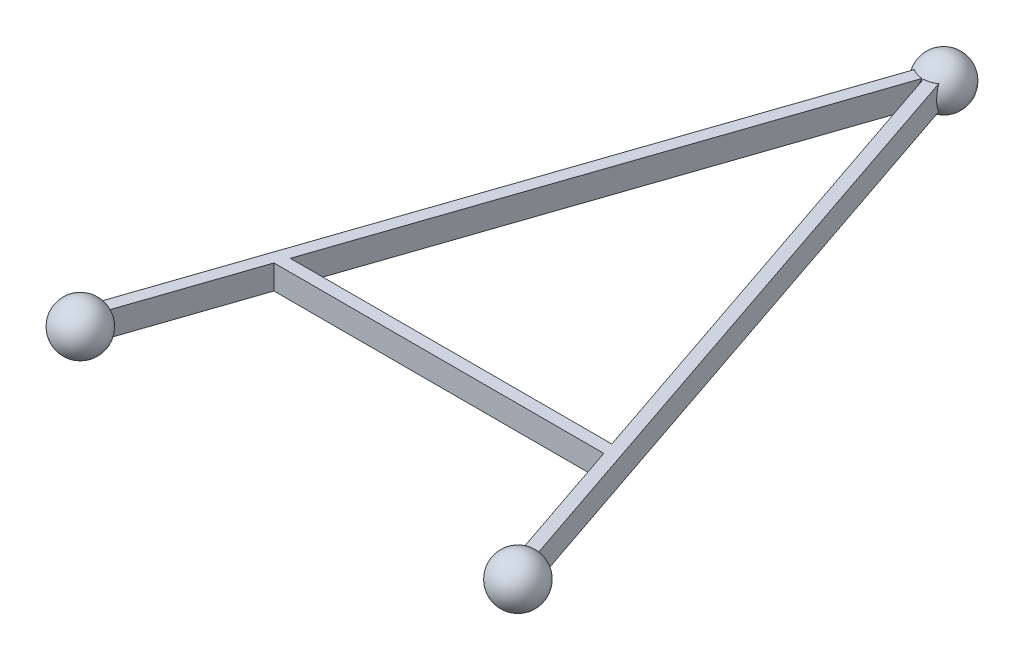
SolidWorks part; units mm, degrees
ref_plane "Front Plane" through (0, 0, 0) normal (0, 0, 1) x (1, 0, 0)
ref_plane "Top Plane" through (0, 0, 0) normal (0, 1, 0) x (1, 0, 0)
ref_plane "Right Plane" through (0, 0, 0) normal (1, 0, 0) x (0, 0, -1)
sketch "Sketch2" plane through (0, 0, 0) normal (0, 1, 0) x (1, 0, 0)
  line L0 (0, 0) -> (-114.3, 336.7297)
  line L1 (-114.3, 336.7297) -> (-228.6, 0)
  line L2 (-228.6, 0) -> (0, 0)
  line L3 (-202.7346, 76.2) -> (-25.8654, 76.2)
  dimension "D1" = 355.6
  dimension "D2" = 228.6
  dimension "D3" = 76.2
sketch "Sketch3" plane through (0, 0, 0) normal (0, 0, 1) x (1, 0, 0)
  line L0 (-228.6, 19.0817) -> (-228.6, -19.0817) construction
  line L1 (-228.6, 12.7) -> (-228.6, -12.7)
  arc A0 (-228.6, -12.7) -> (-228.6, 12.7) centre (-228.6, 0) ccw
  dimension "D1" = 25.4
revolve "Revolve1" add sketch "Sketch3" angle 360 about L0
sketch "Sketch4" plane through (0, 0, 0) normal (0, 0, 1) x (1, 0, 0)
  line L0 (0, 22.7949) -> (0, -23.105) construction
  line L1 (0, 12.7) -> (0, -12.7)
  arc A0 (0, 12.7) -> (0, -12.7) centre (0, 0) ccw
  dimension "D1" = 25.4
revolve "Revolve2" add sketch "Sketch4" angle 360 about L0
sketch "Sketch6" plane through (0, 0, 0) normal (0, 0, 1) x (1, 0, 0)
  line L0 (0, 0) -> (0, 50.0726) construction
ref_plane "Plane1" through (0, 0, 0) normal (0.9469, 0, -0.3214) x (-0.3214, 0, -0.9469)
sketch "Sketch7" plane through (0, 0, 0) normal (0.9469, 0, -0.3214) x (-0.3214, 0, -0.9469)
  line L0 (355.6, -33.2408) -> (355.6, 33.2408) construction
  line L1 (355.6, 12.7) -> (355.6, -12.7)
  arc A0 (355.6, 12.7) -> (355.6, -12.7) centre (355.6, 0) ccw
  dimension "D1" = 25.4
revolve "Revolve3" add sketch "Sketch7" angle 360 about L0
ref_plane "Plane2" through (-228.6, 0, 0) normal (-0.3214, 0, 0.9469) x (0.9469, 0, 0.3214)
sketch "Sketch8" plane through (-228.6, 0, 0) normal (-0.3214, 0, 0.9469) x (0.9469, 0, 0.3214)
  line L0 (-3.175, 6.35) -> (3.175, -6.35) construction
  line L1 (-3.175, 6.35) -> (3.175, 6.35)
  line L2 (-3.175, 6.35) -> (-3.175, -6.35)
  line L3 (-3.175, -6.35) -> (3.175, -6.35)
  line L4 (3.175, 6.35) -> (3.175, -6.35)
  dimension "D1" = 12.7
  dimension "D2" = 6.35
extrude "Extrude3" add sketch "Sketch8" against normal up to surface (345.0697 mm away)
ref_plane "Plane3" through (0, 0, 0) normal (-0.3214, 0, -0.9469) x (-0.9469, 0, 0.3214)
sketch "Sketch9" plane through (0, 0, 0) normal (-0.3214, 0, -0.9469) x (-0.9469, 0, 0.3214)
  line L0 (3.175, 6.35) -> (-3.175, -6.35) construction
  line L1 (3.175, 6.35) -> (-3.175, 6.35)
  line L2 (3.175, 6.35) -> (3.175, -6.35)
  line L3 (3.175, -6.35) -> (-3.175, -6.35)
  line L4 (-3.175, 6.35) -> (-3.175, -6.35)
  dimension "D1" = 6.35
  dimension "D2" = 12.7
extrude "Extrude4" add sketch "Sketch9" along normal up to surface (345.0697 mm away)
ref_plane "Plane4" through (-25.8654, 0, -76.2) normal (1, 0, 0) x (0, 0, -1)
sketch "Sketch10" plane through (-25.8654, 0, -76.2) normal (1, 0, 0) x (0, 0, -1)
  line L0 (-3.175, 6.35) -> (3.175, -6.35) construction
  line L1 (-3.175, 6.35) -> (3.175, 6.35)
  line L2 (-3.175, 6.35) -> (-3.175, -6.35)
  line L3 (-3.175, -6.35) -> (3.175, -6.35)
  line L4 (3.175, 6.35) -> (3.175, -6.35)
  dimension "D1" = 12.7
  dimension "D2" = 6.35
extrude "Extrude5" add sketch "Sketch10" against normal up to surface (172.4385 mm away)
sketch3d "3DSketch1"
  point P0 (-228.6, 0, 0)
  point P1 (0, 0, 0)
